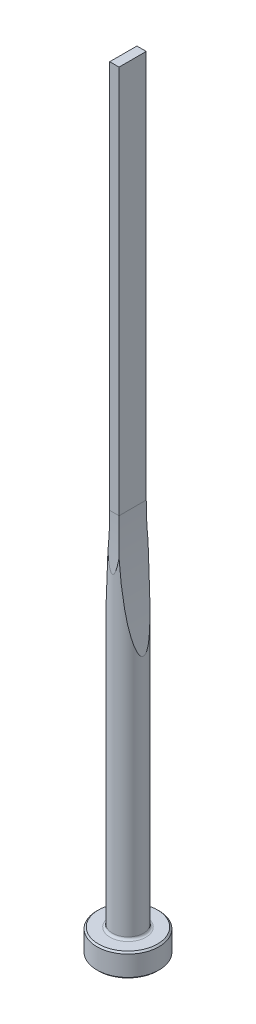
SolidWorks part; units mm, degrees
ref_plane "Front Plane" through (0, 0, 0) normal (0, 0, 1) x (1, 0, 0)
ref_plane "Top Plane" through (0, 0, 0) normal (0, 1, 0) x (1, 0, 0)
ref_plane "Right Plane" through (0, 0, 0) normal (1, 0, 0) x (0, 0, -1)
sketch "Sketch1" plane through (0, 0, 0) normal (0, 0, 1) x (1, 0, 0)
  line L0 (0, 0) -> (3.8, 0)
  line L1 (55, 0) -> (-55, 0) construction
  line L2 (4, 0.2) -> (4, 2.8)
  line L3 (3.8, 3) -> (2.3, 3)
  line L4 (2, 3.3) -> (2, 100)
  line L5 (0, 100) -> (2, 100)
  line L6 (4, 2.8) -> (3.8, 3)
  line L7 (3.8, 0) -> (4, 0.2)
  line L8 (0, 100) -> (0, 0)
  arc A0 (2, 3.3) -> (2.3, 3) centre (2.3, 3.3) ccw
  point P1 (4, 0)
  point P6 (4, 3)
  dimension "D4" = 0.3
  dimension "D1" = 2
  dimension "D2" = 4
  dimension "D3" = 3
  dimension "D5" = 100
revolve "Revolve1" add sketch "Sketch1" angle 360 about L8
sketch "Sketch2" plane through (0, 0, 0) normal (0, 0, 1) x (1, 0, 0)
  line L0 (0.6, 100) -> (0.6, 50)
  line L1 (2, 100) -> (-2, 100) construction
  line L2 (-0.6, 100) -> (-0.6, 50)
  line L3 (2, 100) -> (2, 34.1873)
  line L4 (-2, 100) -> (-2, 34.1873)
  line L5 (0, -4.4) -> (0, 4.4) construction
  line L6 (2, 100) -> (0.6, 100)
  line L8 (-0.6, 100) -> (-2, 100)
  arc A0 (0.6, 50) -> (2, 34.1873) centre (90.6, 50) ccw
  arc A1 (-0.6, 50) -> (-2, 34.1873) centre (-90.6, 50) cw
  dimension "D4" = 90
  dimension "D1" = 50
  dimension "D2" = 1.2
  dimension "D3" = 0.6
extrude "Cut-Extrude1" cut sketch "Sketch2" against normal mid plane 10
sketch "Sketch3" plane through (0, 0, 0) normal (1, 0, 0) x (0, 0, -1)
  line L0 (1.75, 100) -> (1.75, 50)
  line L1 (-1.9079, 100) -> (1.9079, 100) construction
  line L2 (-1.75, 100) -> (-1.75, 50)
  line L3 (2, 100) -> (2, 43.2965)
  line L4 (1.75, 100) -> (2, 100)
  line L5 (0, 4.4) -> (0, -4.4) construction
  line L6 (-2, 100) -> (-2, 43.2965)
  line L8 (-1.75, 100) -> (-2, 100)
  arc A0 (1.75, 50) -> (2, 43.2965) centre (91.75, 50) ccw
  arc A1 (-1.75, 50) -> (-2, 43.2965) centre (-91.75, 50) cw
  dimension "D2" = 90
  dimension "D1" = 50
  dimension "D3" = 3.5
  dimension "D4" = 1.75
extrude "Cut-Extrude2" cut sketch "Sketch3" against normal mid plane 10
